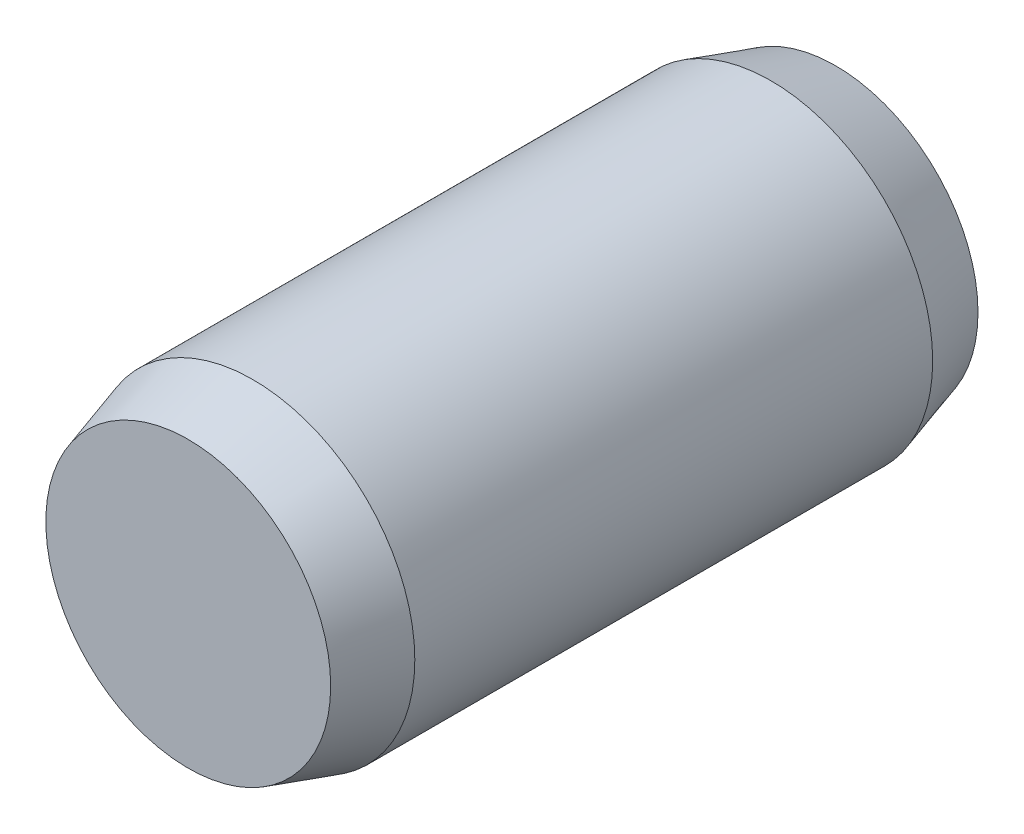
SolidWorks part; units mm, degrees
ref_plane "Piano frontale" through (0, 0, 0) normal (0, 0, 1) x (1, 0, 0)
ref_plane "Piano superiore" through (0, 0, 0) normal (0, 1, 0) x (1, 0, 0)
ref_plane "Piano destro" through (0, 0, 0) normal (1, 0, 0) x (0, 0, -1)
sketch "Schizzo1" plane through (0, 0, 0) normal (0, 0, 1) x (1, 0, 0)
  circle A0 centre (0, 0) radius 2.5
  dimension "D1" = 5
extrude "Estrusione-Estrusione1" add sketch "Schizzo1" along normal blind 10
chamfer "Smusso1" distance 1 distance2 0.3 1 edges at (2.5, 0, 10)
chamfer "Smusso2" distance 0.3 distance2 1 1 edges at (2.5, 0, 0)
